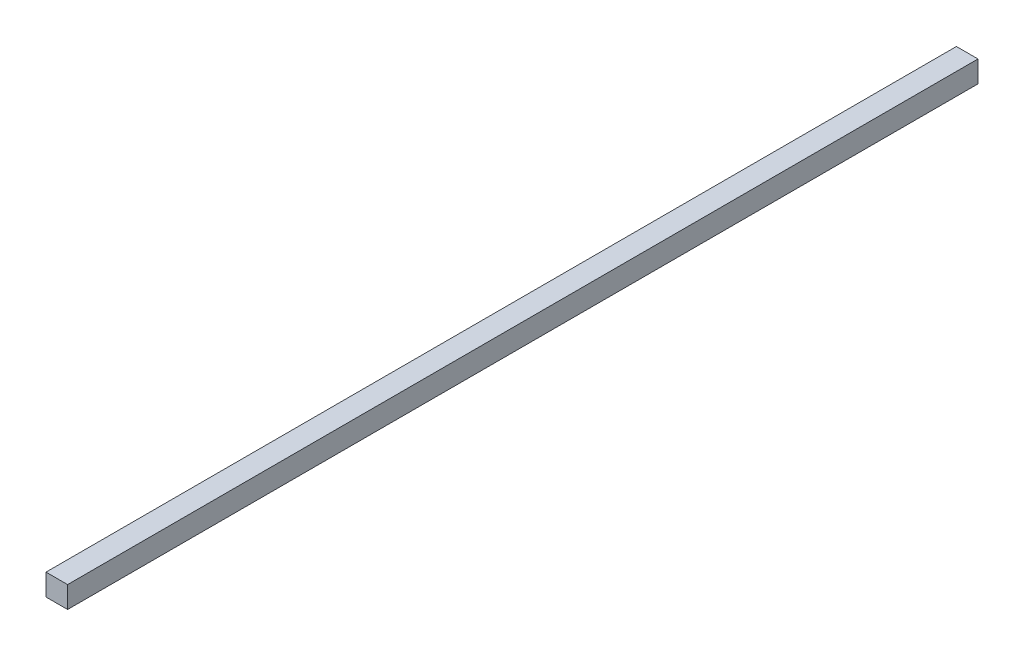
SolidWorks part; units mm, degrees
ref_plane "Front Plane" through (0, 0, 0) normal (0, 0, 1) x (1, 0, 0)
ref_plane "Top Plane" through (0, 0, 0) normal (0, 1, 0) x (1, 0, 0)
ref_plane "Right Plane" through (0, 0, 0) normal (1, 0, 0) x (0, 0, -1)
sketch "Sketch2" plane through (0, 0, 0) normal (0, 0, 1) x (1, 0, 0)
  line L1 (0, 0) -> (6.35, 0)
  line L2 (0, 0) -> (0, 6.35)
  line L3 (0, 6.35) -> (6.35, 6.35)
  line L4 (6.35, 0) -> (6.35, 6.35)
  dimension "D1" = 6.35
  dimension "D2" = 6.35
extrude "Boss-Extrude1" add sketch "Sketch2" along normal blind 267.758
